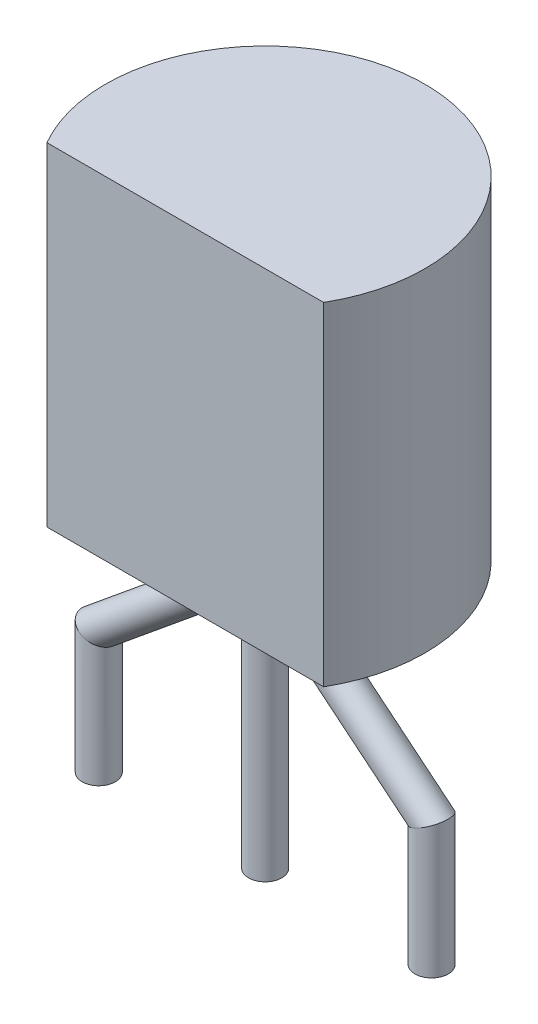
SolidWorks part; units mm, degrees
ref_plane "Plan de face" through (0, 0, 0) normal (0, 0, 1) x (1, 0, 0)
ref_plane "Plan de dessus" through (0, 0, 0) normal (0, 1, 0) x (1, 0, 0)
ref_plane "Plan de droite" through (0, 0, 0) normal (1, 0, 0) x (0, 0, -1)
sketch "Esquisse2" plane through (0, 0, 0) normal (0, 1, 0) x (1, 0, 0)
  line L0 (-2.0785, -1.2) -> (2.0785, -1.2)
  arc A0 (2.0785, -1.2) -> (-2.0785, -1.2) centre (0, 0) ccw
  dimension "D1" = 4.8
  dimension "D2" = 1.2
extrude "Extrusion1" add sketch "Esquisse2" along normal blind 5
sketch "Esquisse5" plane through (0, 0, 0) normal (0, -1, 0) x (1, 0, 0)
  line L0 (-1, 0) -> (0, 0) construction
  line L1 (0, 0) -> (1, 0) construction
  circle A0 centre (0, 0) radius 0.25
  circle A1 centre (-1, 0) radius 0.25
  circle A2 centre (1, 0) radius 0.25
  dimension "D1" = 0.5
  dimension "D2" = 2
sketch "Esquisse4" plane through (0, 0, 0) normal (0, 0, 1) x (1, 0, 0)
  line L0 (0, 0) -> (0, -4)
  line L1 (-1, 0) -> (-1, -0.871)
  line L2 (-1.25, 0) -> (-0.75, 0) construction
  line L3 (-1, -0.871) -> (-2.5, -2.1025)
  line L4 (-2.5, -2.1025) -> (-2.5, -4)
  line L5 (1, 0) -> (1, -0.871)
  line L6 (0.75, 0) -> (1.25, 0) construction
  line L7 (1, -0.871) -> (2.5, -2.1025)
  line L8 (2.5, -2.1025) -> (2.5, -4)
  line L9 (-2.0785, 5) -> (2.0785, 5) construction
  dimension "D1" = 9
  dimension "D2" = 5
sketch "Esquisse6" plane through (0, 0, 0) normal (0, -1, 0) x (1, 0, 0)
  circle A0 centre (0, 0) radius 0.25
  circle A1 centre (0, 0) radius 0.25 construction
sketch "Esquisse7" plane through (0, 0, 0) normal (0, 0, 1) x (1, 0, 0)
  line L0 (0, 0) -> (0, -4)
sweep "Balayage1" add profiles "Esquisse6" path "Esquisse7"
sketch "Esquisse8" plane through (0, 0, 0) normal (0, -1, 0) x (1, 0, 0)
  circle A0 centre (-1, 0) radius 0.25
  circle A1 centre (-1, 0) radius 0.25 construction
sketch "Esquisse9" plane through (0, 0, 0) normal (0, 0, 1) x (1, 0, 0)
  line L0 (-1, 0) -> (-1, -0.871)
  line L1 (-1, -0.871) -> (-2.5, -2.1025)
  line L2 (-2.5, -2.1025) -> (-2.5, -4)
sweep "Balayage2" add profiles "Esquisse8" path "Esquisse9"
sketch "Esquisse10" plane through (0, 0, 0) normal (0, -1, 0) x (1, 0, 0)
  circle A0 centre (1, 0) radius 0.25
  circle A1 centre (1, 0) radius 0.25 construction
sketch "Esquisse11" plane through (0, 0, 0) normal (0, 0, 1) x (1, 0, 0)
  line L0 (1, 0) -> (1, -0.871)
  line L1 (1, -0.871) -> (2.5, -2.1025)
  line L2 (2.5, -2.1025) -> (2.5, -4)
sweep "Balayage3" add profiles "Esquisse10" path "Esquisse11"
